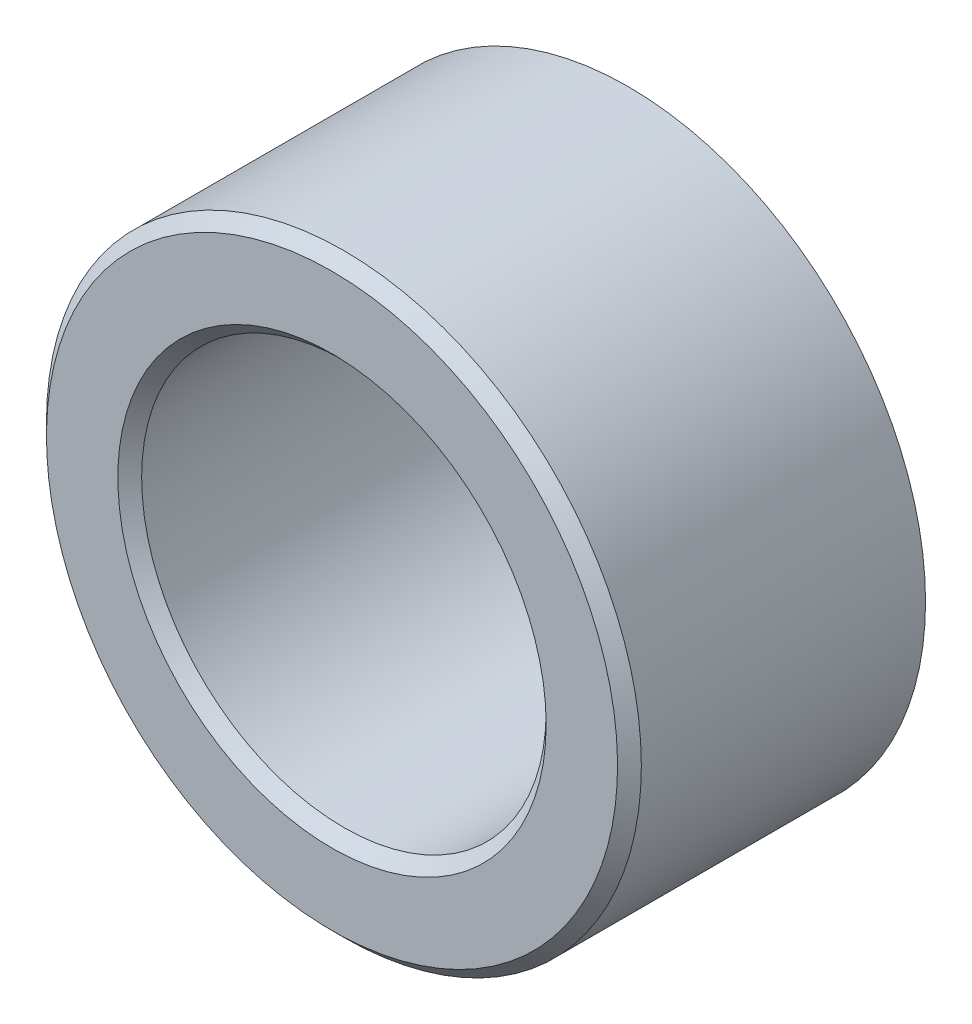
SolidWorks part; units mm, degrees
ref_plane "Front Plane" through (0, 0, 0) normal (0, 0, 1) x (1, 0, 0)
ref_plane "Top Plane" through (0, 0, 0) normal (0, 1, 0) x (1, 0, 0)
ref_plane "Right Plane" through (0, 0, 0) normal (1, 0, 0) x (0, 0, -1)
imported_body "Imported1"
sketch "Sketch1" plane through (0, 0, 0) normal (0, 0, -1) x (-1, 0, 0)
  circle A0 centre (0, 0) radius 18.6979
extrude "Cut-Extrude1" cut sketch "Sketch1" against normal blind 4.1072
